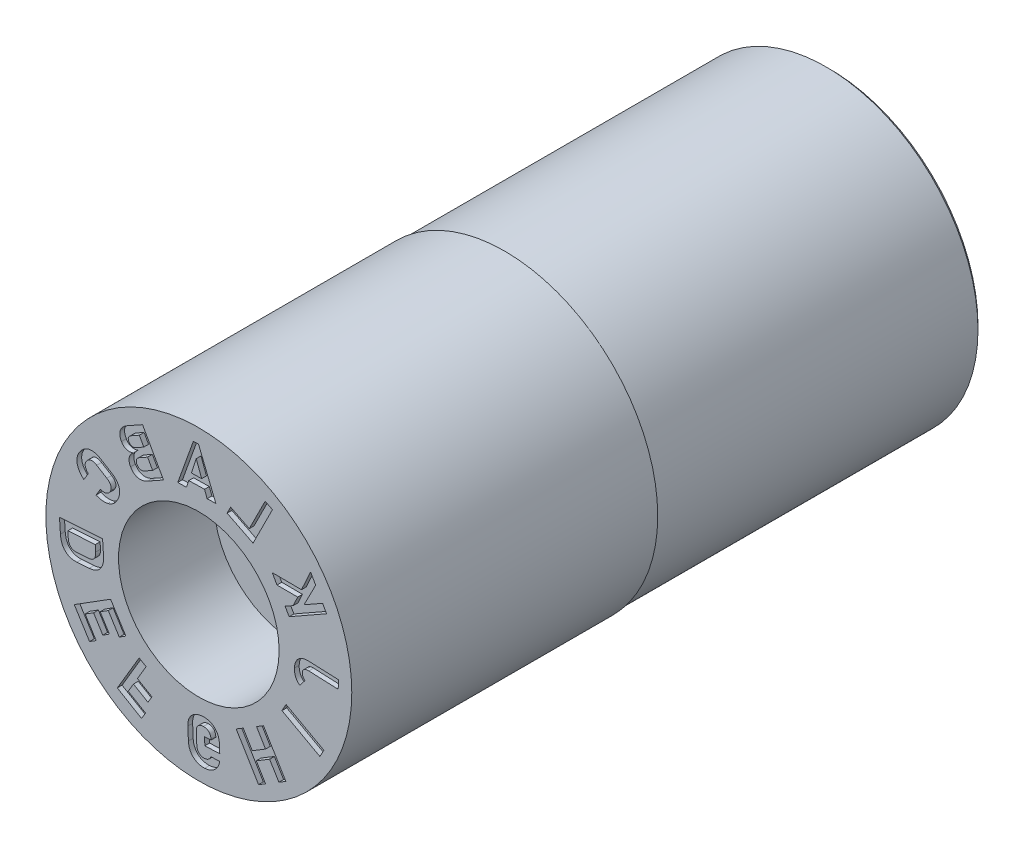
SolidWorks part; units mm, degrees
ref_plane "Front Plane" through (0, 0, 0) normal (0, 0, 1) x (1, 0, 0)
ref_plane "Top Plane" through (0, 0, 0) normal (0, 1, 0) x (1, 0, 0)
ref_plane "Right Plane" through (0, 0, 0) normal (1, 0, 0) x (0, 0, -1)
sketch "Sketch1" plane through (0, 0, 0) normal (1, 0, 0) x (0, 0, -1)
  line L2 (0, 8) -> (0, 4.2)
  line L3 (32.75, 8) -> (0, 8)
  line L4 (-3.7979, 0) -> (49996.2021, 0) construction
  line L8 (25, 1.75) -> (5, 1.75)
  line L9 (5, 4.2) -> (5, 1.75)
  line L10 (5, 4.2) -> (0, 4.2)
  line L12 (33, 4) -> (33, 7.75)
  line L16 (33, 7.75) -> (32.75, 8)
  line L17 (33, 4) -> (25, 4)
  line L18 (25, 1.75) -> (25, 4)
  dimension "D1" = 33
  dimension "D2" = 45
  dimension "D3" = 0.25
  dimension "D4" = 16
  dimension "D5" = 8.4
  dimension "D6" = 5
  dimension "D7" = 3.5
  dimension "D8" = 8
  dimension "D9" = 8
revolve "Revolve1" add sketch "Sketch1" angle 360 about L4
sketch "Sketch4" plane through (0, 0, 0) normal (1, 0, 0) x (0, 0, -1)
  line L0 (0, 0) -> (50000, 0) construction
  line L1 (33, -7.75) -> (33, 7.75) construction
  line L2 (16, 8.935) -> (33, 8.935)
  line L3 (16, 8.935) -> (16, 7.935)
  line L4 (16, 7.935) -> (33, 7.935)
  line L5 (33, 8.935) -> (33, 7.935)
  line L6 (32.75, 8) -> (0, 8) construction
  line L9 (0, 8.8) -> (0, -8.8) construction
  dimension "D1" = 1
  dimension "D2" = 0.065
  dimension "D3" = 16
revolve "Cut-Revolve1" cut sketch "Sketch4" angle 360 about L0
sketch "Sketch2" plane through (0, 0, 0) normal (0, 0, 1) x (1, 0, 0)
  line L0 (0, 0) -> (0, 8) construction
  line L1 (0, 0) -> (4, 6.9282) construction
  line L2 (0, 0) -> (6.9282, 4) construction
  line L3 (0, 0) -> (8, 0) construction
  line L4 (0, 0) -> (6.9282, -4) construction
  line L5 (0, 0) -> (4, -6.9282) construction
  line L6 (0, 0) -> (0, -8) construction
  line L7 (0, 0) -> (-4, -6.9282) construction
  line L8 (0, 0) -> (-6.9282, -4) construction
  line L9 (0, 0) -> (-8, 0) construction
  line L10 (0, 0) -> (-6.9282, 4) construction
  line L11 (0, 0) -> (-4, 6.9282) construction
  line L12 (5.5022, 2.7338) -> (6.1109, 3.9236)
  line L13 (6.1109, 3.9236) -> (5.8468, 4.3887)
  line L14 (5.8468, 4.3887) -> (5.3673, 3.3473)
  line L16 (6.6828, 2.9153) -> (6.4731, 3.2846)
  line L17 (6.4731, 3.2846) -> (5.5022, 2.7338)
  line L18 (4.5132, 2.1727) -> (4.7229, 1.8034)
  line L19 (4.7229, 1.8034) -> (6.6828, 2.9153)
  line L20 (4.9373, 2.4133) -> (4.5132, 2.1727)
  line L21 (5.3673, 3.3473) -> (3.8404, 3.3592)
  line L22 (3.8404, 3.3592) -> (4.0889, 2.9207)
  line L23 (4.0889, 2.9207) -> (5.1687, 2.9159)
  line L24 (3.8504, 6.2143) -> (3.469, 6.4057)
  line L25 (3.469, 6.4057) -> (2.6386, 4.7499)
  line L26 (-3.1134, 6.1055) -> (-2.878, 5.6852)
  line L27 (2.8357, 4.1912) -> (3.8504, 6.2143)
  line L28 (2.6386, 4.7499) -> (1.6648, 5.2383)
  line L29 (1.6648, 5.2383) -> (1.4807, 4.8709)
  line L30 (1.4807, 4.8709) -> (2.8357, 4.1912)
  line L31 (-2.6789, 5.3298) -> (-2.415, 4.8587)
  line L32 (-0.0167, 7.2491) -> (-0.2862, 7.2434)
  line L33 (-0.2862, 7.2434) -> (-1.1013, 4.9722)
  line L34 (-1.1013, 4.9722) -> (-0.6439, 4.9817)
  line L35 (-0.6439, 4.9817) -> (-0.5249, 5.3455)
  line L36 (-0.1369, 6.5319) -> (0.1486, 5.7689)
  line L37 (0.4348, 5.0042) -> (0.8917, 5.0137)
  line L38 (0.8917, 5.0137) -> (-0.0167, 7.2491)
  line L39 (0.1486, 5.7689) -> (-0.3901, 5.7576)
  line L40 (-0.3901, 5.7576) -> (-0.1369, 6.5319)
  line L41 (-0.5249, 5.3455) -> (0.3006, 5.3628)
  line L42 (0.3006, 5.3628) -> (0.4348, 5.0042)
  line L43 (-2.415, 4.8587) -> (-2.8321, 4.6251)
  line L44 (-3.2277, 4.7095) -> (-3.2301, 4.7135)
  line L45 (-3.0961, 5.0962) -> (-2.6789, 5.3298)
  line L46 (-5.0058, 0.0301) -> (-5.0337, 0.4549)
  line L47 (-2.878, 5.6852) -> (-3.2953, 5.4515)
  line L48 (-3.5305, 5.8719) -> (-3.1134, 6.1055)
  line L49 (-5.1604, -2.9155) -> (-4.7345, -2.6478)
  line L50 (-2.9436, 6.6678) -> (-3.742, 6.2204)
  line L51 (-3.571, 4.4502) -> (-3.569, 4.4463)
  line L52 (-2.6684, 4.2499) -> (-2.5061, 4.3407)
  line L54 (-3.21, -4.9661) -> (-2.7564, -4.1993)
  line L56 (-2.5061, 4.3407) -> (-1.8469, 4.7101)
  line L57 (-1.8469, 4.7101) -> (-2.9436, 6.6678)
  line L58 (-4.5788, 3.6842) -> (-5.1079, 4.0081)
  line L59 (-6.0126, 2.6523) -> (-5.7818, 3.0295)
  line L60 (-5.3385, 3.6315) -> (-4.8094, 3.3076)
  line L61 (-5.1451, 2.6396) -> (-5.3759, 2.2624)
  line L62 (-5.4148, 0.0031) -> (-5.393, -0.3272)
  line L63 (-5.7501, -0.7911) -> (-6.4137, -0.8349)
  line L64 (-6.8281, -0.4216) -> (-6.8499, -0.0915)
  line L65 (3.7029, -5.1609) -> (4.1861, -5.9625)
  line L66 (2.7943, -5.2287) -> (2.3207, -4.443)
  line L67 (-6.3719, -1.274) -> (-5.7332, -1.2317)
  line L68 (-4.9848, -0.2891) -> (-5.0058, 0.0301)
  line L69 (5.1687, 2.9159) -> (4.9373, 2.4133)
  line L70 (-7.2871, 0.3063) -> (-7.2381, -0.4391)
  line L71 (-6.8499, -0.0915) -> (-5.4148, 0.0031)
  line L73 (-5.0337, 0.4549) -> (-7.2871, 0.3063)
  line L75 (-5.9442, -3.4083) -> (-5.5052, -3.1323)
  line L77 (-4.6143, -2.0728) -> (-6.5139, -3.2669)
  line L78 (-4.7345, -2.6478) -> (-4.1597, -3.5626)
  line L79 (-4.1597, -3.5626) -> (-3.8146, -3.3458)
  line L80 (-3.8146, -3.3458) -> (-4.6143, -2.0728)
  line L82 (-5.5052, -3.1323) -> (-5.0206, -3.9031)
  line L83 (-5.0206, -3.9031) -> (-4.6759, -3.6861)
  line L84 (-4.6759, -3.6861) -> (-5.1604, -2.9155)
  line L86 (-6.5139, -3.2669) -> (-5.7142, -4.54)
  line L87 (-5.7142, -4.54) -> (-5.3695, -4.3229)
  line L88 (-5.3695, -4.3229) -> (-5.9442, -3.4083)
  line L91 (-3.6915, -5.7802) -> (-3.4173, -5.3166)
  line L92 (-2.7564, -4.1993) -> (-3.1205, -3.9839)
  line L93 (-3.1205, -3.9839) -> (-4.2629, -5.9153)
  line L94 (-3.4173, -5.3166) -> (-2.6593, -5.7651)
  line L95 (-2.6593, -5.7651) -> (-2.4518, -5.4147)
  line L96 (-2.4518, -5.4147) -> (-3.21, -4.9661)
  line L98 (-4.2629, -5.9153) -> (-2.9944, -6.6659)
  line L99 (-2.9944, -6.6659) -> (-2.7868, -6.3155)
  line L100 (-2.7868, -6.3155) -> (-3.6915, -5.7802)
  line L102 (1.0965, -6.2167) -> (1.0781, -5.7763)
  line L103 (-0.5731, -5.796) -> (-0.5454, -6.461)
  line L104 (1.0923, -6.565) -> (0.6335, -6.5842)
  line L105 (-0.1055, -6.4426) -> (-0.1331, -5.7775)
  line L106 (0.6371, -5.7888) -> (0.6389, -5.826)
  line L107 (0.6389, -5.826) -> (0.2982, -5.8405)
  line L108 (0.2982, -5.8405) -> (0.3154, -6.2497)
  line L109 (0.3154, -6.2497) -> (1.0965, -6.2167)
  line L110 (4.1861, -5.9625) -> (4.5515, -5.7424)
  line L111 (4.5515, -5.7424) -> (3.3828, -3.8033)
  line L112 (3.3828, -3.8033) -> (3.0174, -4.0234)
  line L113 (3.0174, -4.0234) -> (3.4908, -4.8088)
  line L114 (3.124, -6.6022) -> (3.4894, -6.3821)
  line L115 (3.4894, -6.3821) -> (3.0064, -5.5807)
  line L116 (2.3207, -4.443) -> (1.9553, -4.6631)
  line L117 (1.9553, -4.6631) -> (3.124, -6.6022)
  line L118 (3.0064, -5.5807) -> (3.7029, -5.1609)
  line L120 (3.4908, -4.8088) -> (2.7943, -5.2287)
  line L122 (4.5597, -2.2498) -> (4.3474, -2.6366)
  line L123 (4.3474, -2.6366) -> (6.3289, -3.7233)
  line L124 (6.3289, -3.7233) -> (6.5413, -3.3365)
  line L125 (6.5413, -3.3365) -> (4.5597, -2.2498)
  line L126 (5.2813, -1.0186) -> (5.5484, -0.6823)
  line L127 (5.7526, -0.1367) -> (7.2883, -0.2026)
  line L128 (7.2883, -0.2026) -> (7.3072, 0.2374)
  line L129 (7.3072, 0.2374) -> (5.7697, 0.3034)
  circle A0 centre (0, 0) radius 5.0987 construction
  circle A1 centre (0, 0) radius 8 construction
  spline S0 degree 3 poles (-2.8321, 4.6251) (-2.8702, 4.605) (-2.928, 4.5785) (-3.0081, 4.5696) (-3.0623, 4.5745) (-3.1124, 4.5917) (-3.1748, 4.6306) (-3.2089, 4.6767) (-3.2277, 4.7095) knots 0 0 0 0 0.283986 0.407341 0.523418 0.636508 0.75074 1 1 1 1
  spline S1 degree 3 poles (-3.2301, 4.7135) (-3.2432, 4.7365) (-3.259, 4.7722) (-3.2692, 4.8217) (-3.2708, 4.8571) (-3.2675, 4.8918) (-3.2583, 4.9253) (-3.2442, 4.958) (-3.2241, 4.9891) (-3.1992, 5.0187) (-3.1588, 5.058) (-3.1217, 5.0812) (-3.0961, 5.0962) knots 0 0 0 0 0.172486 0.251676 0.328325 0.402454 0.477689 0.553909 0.633799 0.717923 0.805334 1 1 1 1
  spline S2 degree 3 poles (-3.2953, 5.4515) (-3.3298, 5.4335) (-3.3822, 5.4091) (-3.4553, 5.4031) (-3.5049, 5.4087) (-3.551, 5.4261) (-3.6094, 5.4632) (-3.6406, 5.5076) (-3.6589, 5.5383) knots 0 0 0 0 0.277832 0.398607 0.514672 0.628815 0.743813 1 1 1 1
  spline S3 degree 3 poles (-3.6589, 5.5383) (-3.6747, 5.5667) (-3.6924, 5.6128) (-3.6913, 5.6765) (-3.6796, 5.7216) (-3.6572, 5.7644) (-3.6111, 5.8201) (-3.5649, 5.8532) (-3.5305, 5.8719) knots 0 0 0 0 0.243006 0.354161 0.466966 0.585008 0.709189 1 1 1 1
  spline S4 degree 3 poles (-3.742, 6.2204) (-3.801, 6.1875) (-3.8833, 6.1329) (-3.9758, 6.0454) (-4.0316, 5.9783) (-4.0762, 5.9079) (-4.1087, 5.8343) (-4.1281, 5.7579) (-4.1361, 5.6794) (-4.1312, 5.599) (-4.1086, 5.4872) (-4.0728, 5.4067) (-4.0438, 5.3548) knots 0 0 0 0 0.194786 0.282854 0.366198 0.445692 0.522431 0.59692 0.672178 0.748789 0.828229 1 1 1 1
  spline S5 degree 3 poles (-4.0438, 5.3548) (-4.0231, 5.3188) (-3.9889, 5.2676) (-3.9316, 5.2113) (-3.8862, 5.1764) (-3.8373, 5.1482) (-3.7852, 5.1264) (-3.7299, 5.1125) (-3.6723, 5.1046) (-3.6122, 5.1042) (-3.5276, 5.1128) (-3.4646, 5.1304) (-3.4229, 5.1453) knots 0 0 0 0 0.172797 0.253868 0.332914 0.410582 0.4882 0.566647 0.646914 0.729831 0.815675 1 1 1 1
  spline S6 degree 3 poles (-3.4229, 5.1453) (-3.4603, 5.1166) (-3.5129, 5.0708) (-3.5681, 4.9988) (-3.601, 4.9437) (-3.6266, 4.8863) (-3.6428, 4.8267) (-3.6523, 4.766) (-3.6519, 4.7037) (-3.6444, 4.6406) (-3.6223, 4.5535) (-3.594, 4.4908) (-3.571, 4.4502) knots 0 0 0 0 0.180058 0.263783 0.344958 0.424782 0.502383 0.580016 0.658446 0.73902 0.822029 1 1 1 1
  spline S7 degree 3 poles (-3.569, 4.4463) (-3.5398, 4.3936) (-3.4889, 4.3208) (-3.4049, 4.2418) (-3.338, 4.196) (-3.2666, 4.161) (-3.1905, 4.1386) (-3.1105, 4.1273) (-3.0268, 4.1285) (-2.94, 4.1411) (-2.8171, 4.1753) (-2.7273, 4.2166) (-2.6684, 4.2499) knots 0 0 0 0 0.172849 0.252224 0.329274 0.404442 0.479146 0.555557 0.635162 0.718344 0.806128 1 1 1 1
  spline S8 degree 3 poles (-4.2869, 2.5455) (-4.2653, 2.581) (-4.2351, 2.6347) (-4.2031, 2.7086) (-4.1825, 2.7625) (-4.1662, 2.816) (-4.1531, 2.8691) (-4.1445, 2.9219) (-4.1396, 2.9743) (-4.1389, 3.0259) (-4.1411, 3.0768) (-4.1482, 3.1268) (-4.1589, 3.1759) (-4.1732, 3.2244) (-4.1915, 3.2719) (-4.2132, 3.3187) (-4.2394, 3.3642) (-4.2688, 3.409) (-4.3025, 3.4521) (-4.3396, 3.4941) (-4.38, 3.5349) (-4.4242, 3.5744) (-4.4895, 3.626) (-4.5418, 3.6622) (-4.5788, 3.6842) knots 0 0 0 0 0.093395 0.137867 0.180685 0.222706 0.263356 0.30334 0.342595 0.381331 0.419141 0.456735 0.494484 0.53194 0.569988 0.608498 0.647681 0.687739 0.728571 0.77031 0.813445 0.857468 0.903297 1 1 1 1
  spline S9 degree 3 poles (-5.1079, 4.0081) (-5.1445, 4.0306) (-5.2, 4.0614) (-5.2757, 4.0958) (-5.331, 4.1174) (-5.3859, 4.1346) (-5.44, 4.1494) (-5.4938, 4.1588) (-5.547, 4.165) (-5.5994, 4.1671) (-5.651, 4.1655) (-5.7018, 4.1605) (-5.7514, 4.1509) (-5.8001, 4.1381) (-5.8476, 4.1214) (-5.8946, 4.1012) (-5.9401, 4.0766) (-5.9847, 4.0486) (-6.028, 4.0172) (-6.0698, 3.9818) (-6.1098, 3.9425) (-6.1487, 3.8999) (-6.1994, 3.8373) (-6.2338, 3.7864) (-6.2555, 3.7509) knots 0 0 0 0 0.096419 0.14217 0.186461 0.229443 0.271255 0.312127 0.351941 0.391171 0.429722 0.467793 0.505489 0.542813 0.580646 0.618521 0.657329 0.6966 0.736521 0.777346 0.819285 0.862414 0.90656 1 1 1 1
  spline S10 degree 3 poles (-6.2555, 3.7509) (-6.2903, 3.6929) (-6.3347, 3.6023) (-6.3668, 3.4741) (-6.3779, 3.3788) (-6.3764, 3.2831) (-6.3621, 3.1878) (-6.3344, 3.0935) (-6.2942, 3.0004) (-6.2421, 2.9088) (-6.1535, 2.7867) (-6.0719, 2.7043) (-6.0126, 2.6523) knots 0 0 0 0 0.164359 0.242523 0.319819 0.396758 0.474197 0.553045 0.634665 0.719808 0.808406 1 1 1 1
  spline S11 degree 3 poles (-5.7818, 3.0295) (-5.8073, 3.0551) (-5.8442, 3.0938) (-5.8826, 3.1515) (-5.9058, 3.1941) (-5.9228, 3.2372) (-5.936, 3.28) (-5.9419, 3.3231) (-5.9435, 3.3657) (-5.9398, 3.4079) (-5.9255, 3.4638) (-5.9077, 3.5037) (-5.892, 3.5285) knots 0 0 0 0 0.195176 0.28654 0.37324 0.456219 0.536212 0.614028 0.690102 0.765908 0.841951 1 1 1 1
  spline S12 degree 3 poles (-5.892, 3.5285) (-5.8729, 3.5605) (-5.8396, 3.6039) (-5.7863, 3.6508) (-5.7448, 3.678) (-5.7004, 3.6975) (-5.6537, 3.7098) (-5.6048, 3.7149) (-5.5537, 3.713) (-5.5013, 3.7028) (-5.4269, 3.6809) (-5.3738, 3.6522) (-5.3385, 3.6315) knots 0 0 0 0 0.174816 0.254583 0.331752 0.4066 0.480982 0.557388 0.636835 0.719716 0.807055 1 1 1 1
  spline S13 degree 3 poles (-4.8094, 3.3076) (-4.7744, 3.2863) (-4.7259, 3.2509) (-4.6717, 3.1957) (-4.6394, 3.1534) (-4.6145, 3.1091) (-4.5972, 3.0631) (-4.5872, 3.016) (-4.5844, 2.9675) (-4.5894, 2.9181) (-4.6069, 2.8492) (-4.6313, 2.8001) (-4.6506, 2.7682) knots 0 0 0 0 0.192502 0.280292 0.362664 0.441768 0.517825 0.592476 0.667438 0.744799 0.824735 1 1 1 1
  spline S14 degree 3 poles (-4.6506, 2.7682) (-4.6663, 2.743) (-4.693, 2.7075) (-4.7372, 2.6696) (-4.7729, 2.6462) (-4.8116, 2.6278) (-4.8526, 2.6131) (-4.8965, 2.6055) (-4.9425, 2.6016) (-4.9907, 2.6028) (-5.0595, 2.6123) (-5.1107, 2.6274) (-5.1451, 2.6396) knots 0 0 0 0 0.160081 0.236116 0.312169 0.388724 0.466101 0.54522 0.627432 0.713977 0.803689 1 1 1 1
  spline S15 degree 3 poles (-5.3759, 2.2624) (-5.3021, 2.234) (-5.1914, 2.1989) (-5.0423, 2.1757) (-4.9371, 2.1711) (-4.8359, 2.1772) (-4.7396, 2.1956) (-4.6485, 2.2259) (-4.5628, 2.2677) (-4.4826, 2.3204) (-4.3838, 2.408) (-4.322, 2.4876) (-4.2869, 2.5455) knots 0 0 0 0 0.192102 0.280672 0.365808 0.447541 0.526353 0.603189 0.680187 0.757178 0.835634 1 1 1 1
  spline S16 degree 3 poles (-5.393, -0.3272) (-5.3912, -0.3601) (-5.39, -0.4085) (-5.3973, -0.4709) (-5.4053, -0.5137) (-5.4166, -0.5539) (-5.4316, -0.5914) (-5.4503, -0.6259) (-5.4721, -0.6578) (-5.497, -0.6864) (-5.5243, -0.7123) (-5.5551, -0.7339) (-5.5886, -0.7523) (-5.6249, -0.7674) (-5.6785, -0.7832) (-5.721, -0.7896) (-5.7501, -0.7911) knots 0 0 0 0 0.14907 0.217385 0.282879 0.345337 0.405621 0.464448 0.522126 0.579343 0.63528 0.691485 0.748535 0.807147 0.868664 1 1 1 1
  spline S17 degree 3 poles (-6.4137, -0.8349) (-6.4427, -0.8368) (-6.4857, -0.8369) (-6.5407, -0.8273) (-6.5791, -0.8181) (-6.6143, -0.8033) (-6.6477, -0.786) (-6.6786, -0.7644) (-6.7068, -0.7389) (-6.7326, -0.7103) (-6.7548, -0.678) (-6.775, -0.6432) (-6.7914, -0.6048) (-6.8054, -0.5636) (-6.8194, -0.5024) (-6.8264, -0.4547) (-6.8281, -0.4216) knots 0 0 0 0 0.131403 0.192788 0.251651 0.30887 0.364824 0.421034 0.478337 0.535992 0.59437 0.654772 0.717284 0.782701 0.85073 1 1 1 1
  spline S18 degree 3 poles (-7.2381, -0.4391) (-7.2352, -0.4845) (-7.2281, -0.5513) (-7.2123, -0.6378) (-7.1976, -0.6986) (-7.1808, -0.7567) (-7.1609, -0.8121) (-7.1383, -0.8647) (-7.1125, -0.9142) (-7.0849, -0.9611) (-7.0536, -1.0043) (-7.0208, -1.0451) (-6.9843, -1.082) (-6.9462, -1.1164) (-6.9052, -1.1472) (-6.862, -1.1751) (-6.816, -1.1994) (-6.7679, -1.2208) (-6.7175, -1.2388) (-6.665, -1.2529) (-6.6105, -1.2645) (-6.5538, -1.2721) (-6.474, -1.2777) (-6.413, -1.2764) (-6.3719, -1.274) knots 0 0 0 0 0.09974 0.147124 0.192678 0.236825 0.279748 0.32161 0.362273 0.402114 0.440851 0.479134 0.516793 0.5544 0.591662 0.629051 0.667054 0.705622 0.744502 0.784211 0.824761 0.866534 0.909716 1 1 1 1
  spline S19 degree 3 poles (-5.7332, -1.2317) (-5.6939, -1.229) (-5.6359, -1.2224) (-5.561, -1.2065) (-5.5074, -1.193) (-5.4565, -1.1745) (-5.4072, -1.1544) (-5.3602, -1.1309) (-5.3154, -1.1045) (-5.2728, -1.0753) (-5.2331, -1.0426) (-5.1962, -1.0069) (-5.1612, -0.9691) (-5.1307, -0.927) (-5.1014, -0.8831) (-5.0758, -0.8355) (-5.0523, -0.7854) (-5.0322, -0.7321) (-5.0149, -0.6765) (-5.0013, -0.6184) (-4.9914, -0.5576) (-4.9846, -0.494) (-4.9796, -0.4042) (-4.9815, -0.3355) (-4.9848, -0.2891) knots 0 0 0 0 0.08643 0.127888 0.168208 0.207699 0.246676 0.285052 0.323013 0.360748 0.398341 0.435858 0.473305 0.51134 0.549953 0.589151 0.629809 0.671474 0.71404 0.757555 0.802537 0.849254 0.897844 1 1 1 1
  spline S20 degree 3 poles (1.0781, -5.7763) (1.0757, -5.7356) (1.0712, -5.6754) (1.0568, -5.5974) (1.0433, -5.5416) (1.0267, -5.4877) (1.0071, -5.4358) (0.9843, -5.386) (0.9585, -5.3384) (0.9299, -5.293) (0.8983, -5.2506) (0.8651, -5.2102) (0.8286, -5.1733) (0.7897, -5.1391) (0.748, -5.1083) (0.7045, -5.0793) (0.658, -5.0541) (0.6097, -5.0315) (0.5594, -5.0121) (0.5072, -4.9966) (0.4536, -4.9834) (0.3981, -4.9744) (0.3209, -4.967) (0.262, -4.9654) (0.2223, -4.9676) knots 0 0 0 0 0.092115 0.136278 0.179365 0.221873 0.263626 0.304798 0.345575 0.386144 0.425925 0.465206 0.504302 0.543232 0.582217 0.621417 0.66136 0.701682 0.742094 0.783109 0.82471 0.866861 0.910182 1 1 1 1
  spline S21 degree 3 poles (0.2223, -4.9676) (0.1824, -4.9699) (0.1232, -4.9742) (0.0466, -4.9887) (-0.0082, -5.0015) (-0.061, -5.0176) (-0.1119, -5.0367) (-0.1609, -5.059) (-0.2078, -5.0841) (-0.2526, -5.1119) (-0.2946, -5.1423) (-0.334, -5.1747) (-0.3705, -5.2099) (-0.4039, -5.2477) (-0.4346, -5.2879) (-0.4632, -5.33) (-0.4879, -5.375) (-0.5106, -5.4217) (-0.5291, -5.4705) (-0.5455, -5.5206) (-0.5572, -5.5727) (-0.5669, -5.626) (-0.5737, -5.7006) (-0.5749, -5.7575) (-0.5731, -5.796) knots 0 0 0 0 0.092699 0.137286 0.180721 0.223201 0.265242 0.306681 0.348035 0.388686 0.428815 0.468113 0.506985 0.546165 0.58512 0.624268 0.664152 0.7041 0.744433 0.785184 0.826279 0.868134 0.910753 1 1 1 1
  spline S22 degree 3 poles (-0.5454, -6.461) (-0.5431, -6.5016) (-0.5386, -6.5618) (-0.5242, -6.6399) (-0.5107, -6.6957) (-0.4941, -6.7495) (-0.4744, -6.8014) (-0.4517, -6.8512) (-0.4261, -6.8988) (-0.3971, -6.9437) (-0.3663, -6.9866) (-0.3326, -7.0264) (-0.2959, -7.0631) (-0.257, -7.097) (-0.216, -7.1289) (-0.1719, -7.1573) (-0.1255, -7.1828) (-0.0771, -7.2053) (-0.0268, -7.2246) (0.0251, -7.2405) (0.0789, -7.2523) (0.1341, -7.262) (0.2113, -7.2696) (0.2701, -7.2701) (0.3098, -7.2683) knots 0 0 0 0 0.09219 0.136389 0.179511 0.222053 0.26384 0.305046 0.345856 0.38615 0.425784 0.465296 0.504158 0.543119 0.582112 0.621617 0.661593 0.701947 0.742391 0.78344 0.824531 0.867138 0.910153 1 1 1 1
  spline S23 degree 3 poles (0.3098, -7.2683) (0.3749, -7.2658) (0.4711, -7.2512) (0.5934, -7.2118) (0.6789, -7.1715) (0.7586, -7.1223) (0.8318, -7.0647) (0.897, -6.998) (0.9547, -6.9239) (1.004, -6.8427) (1.0576, -6.7249) (1.0822, -6.6299) (1.0923, -6.565) knots 0 0 0 0 0.17073 0.253555 0.336069 0.417894 0.498687 0.579505 0.661559 0.744543 0.827905 1 1 1 1
  spline S24 degree 3 poles (0.6335, -6.5842) (0.6265, -6.6075) (0.6135, -6.6422) (0.5861, -6.6827) (0.5629, -6.7112) (0.5359, -6.7364) (0.5062, -6.7589) (0.4743, -6.7787) (0.4402, -6.7956) (0.4042, -6.8084) (0.3551, -6.8224) (0.3168, -6.8266) (0.2913, -6.8279) knots 0 0 0 0 0.163545 0.244363 0.326081 0.408336 0.490616 0.574314 0.658826 0.744665 0.82891 1 1 1 1
  spline S25 degree 3 poles (0.2913, -6.8279) (0.2556, -6.8294) (0.2027, -6.8261) (0.1359, -6.8079) (0.09, -6.7882) (0.0481, -6.7622) (0.0105, -6.7307) (-0.022, -6.6936) (-0.0502, -6.6516) (-0.0728, -6.6048) (-0.0967, -6.5358) (-0.1036, -6.4802) (-0.1055, -6.4426) knots 0 0 0 0 0.172158 0.253143 0.33268 0.411758 0.489998 0.568044 0.648935 0.732772 0.817932 1 1 1 1
  spline S26 degree 3 poles (-0.1331, -5.7775) (-0.1351, -5.7441) (-0.1309, -5.6946) (-0.1131, -5.6321) (-0.0936, -5.5894) (-0.0687, -5.55) (-0.0383, -5.515) (-0.0027, -5.4843) (0.0383, -5.4588) (0.0835, -5.438) (0.1504, -5.4162) (0.2042, -5.4103) (0.2408, -5.408) knots 0 0 0 0 0.169496 0.249303 0.328489 0.406527 0.484423 0.562784 0.643966 0.728133 0.814124 1 1 1 1
  spline S27 degree 3 poles (0.2408, -5.408) (0.2768, -5.4068) (0.3303, -5.4094) (0.3979, -5.427) (0.4438, -5.4462) (0.4859, -5.4705) (0.5232, -5.5013) (0.5558, -5.5373) (0.5836, -5.5786) (0.6052, -5.625) (0.6287, -5.6944) (0.6348, -5.7506) (0.6371, -5.7888) knots 0 0 0 0 0.174469 0.256028 0.336001 0.413903 0.490188 0.568212 0.647583 0.729648 0.81477 1 1 1 1
  spline S28 degree 3 poles (4.9991, -0.3837) (4.9964, -0.4495) (5.0016, -0.5469) (5.03, -0.6713) (5.0619, -0.7567) (5.1029, -0.8354) (5.1701, -0.929) (5.2339, -0.9871) (5.2813, -1.0186) knots 0 0 0 0 0.271973 0.400312 0.525574 0.647267 0.765611 1 1 1 1
  spline S29 degree 3 poles (5.5484, -0.6823) (5.5259, -0.6635) (5.4957, -0.6313) (5.4633, -0.5827) (5.4436, -0.544) (5.4282, -0.5038) (5.4146, -0.4487) (5.411, -0.4063) (5.4126, -0.3782) knots 0 0 0 0 0.255231 0.381316 0.506998 0.632723 0.755324 1 1 1 1
  spline S30 degree 3 poles (5.4126, -0.3782) (5.4142, -0.3415) (5.4252, -0.2863) (5.4663, -0.2265) (5.5063, -0.1904) (5.5561, -0.1633) (5.6384, -0.1385) (5.7059, -0.1342) (5.7526, -0.1367) knots 0 0 0 0 0.235579 0.344935 0.456481 0.574963 0.702365 1 1 1 1
  spline S31 degree 3 poles (5.7697, 0.3034) (5.697, 0.3071) (5.5906, 0.3017) (5.4559, 0.272) (5.3806, 0.2439) (5.3249, 0.2164) (5.2862, 0.1928) (5.249, 0.1678) (5.2154, 0.1389) (5.1834, 0.1085) (5.1536, 0.0755) (5.1268, 0.0396) (5.102, 0.0015) (5.0802, -0.0391) (5.0607, -0.0819) (5.044, -0.1268) (5.0297, -0.1739) (5.0181, -0.2232) (5.0058, -0.2932) (5.0008, -0.3472) (4.9991, -0.3837) knots 0 0 0 0 0.185997 0.270621 0.35164 0.390622 0.429278 0.467346 0.504968 0.542395 0.580108 0.618424 0.656924 0.69617 0.736012 0.777014 0.8186 0.861699 0.906468 1 1 1 1
  point P19 (0, 0)
  dimension "D1" = 12
extrude "Cut-Extrude1" cut sketch "Sketch2" against normal blind 0.25
sketch "Sketch3" plane through (0, 0, -5) normal (0, 0, 1) x (1, 0, 0)
  line L0 (0, 0) -> (0, 50000) construction
  line L1 (1.0104, 1.75) -> (-1.0104, 1.75)
  line L2 (-1.0104, 1.75) -> (-2.0207, 0)
  line L3 (-2.0207, 0) -> (-1.0104, -1.75)
  line L4 (-1.0104, -1.75) -> (1.0104, -1.75)
  line L5 (1.0104, -1.75) -> (2.0207, 0)
  line L6 (2.0207, 0) -> (1.0104, 1.75)
  line L7 (0, 0) -> (50000, 0) construction
  circle A0 centre (0, 0) radius 1.75 construction
  circle A1 centre (0, 0) radius 1.75 construction
extrude "Cut-Extrude2" cut sketch "Sketch3" against normal blind 4
